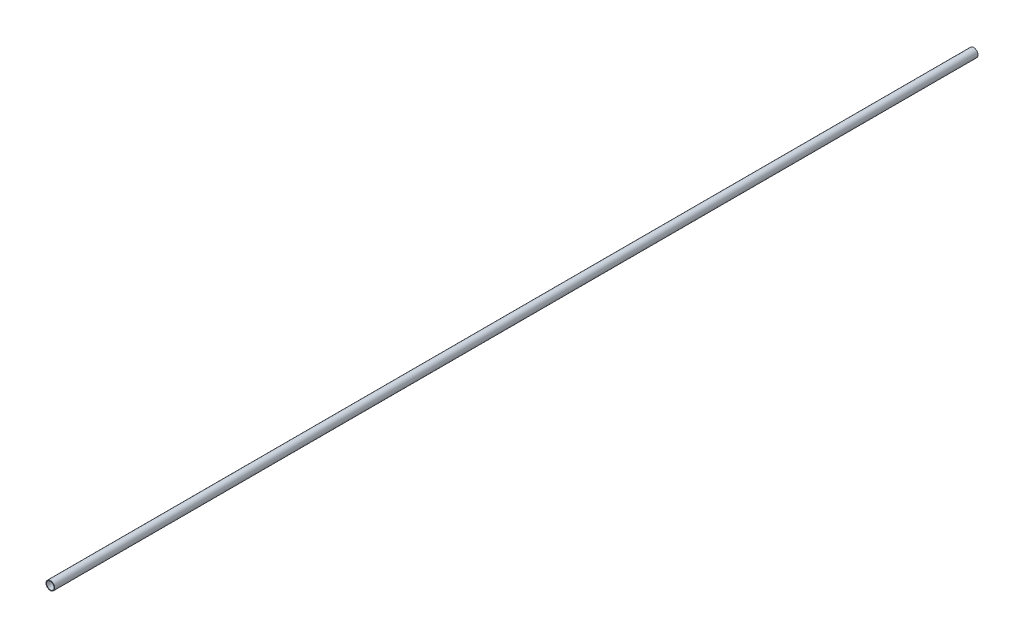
SolidWorks part; units mm, degrees
ref_plane "Front Plane" through (0, 0, 0) normal (0, 0, 1) x (1, 0, 0)
ref_plane "Top Plane" through (0, 0, 0) normal (0, 1, 0) x (1, 0, 0)
ref_plane "Right Plane" through (0, 0, 0) normal (1, 0, 0) x (0, 0, -1)
sketch "Sketch1" plane through (0, 0, 0) normal (0, 0, 1) x (1, 0, 0)
  circle A0 centre (0, 0) radius 9.525
  circle A1 centre (0, 0) radius 8.255
  dimension "D1" = 19.05
  dimension "D2" = 1.27
extrude "Boss-Extrude1" add sketch "Sketch1" along normal blind 2032
